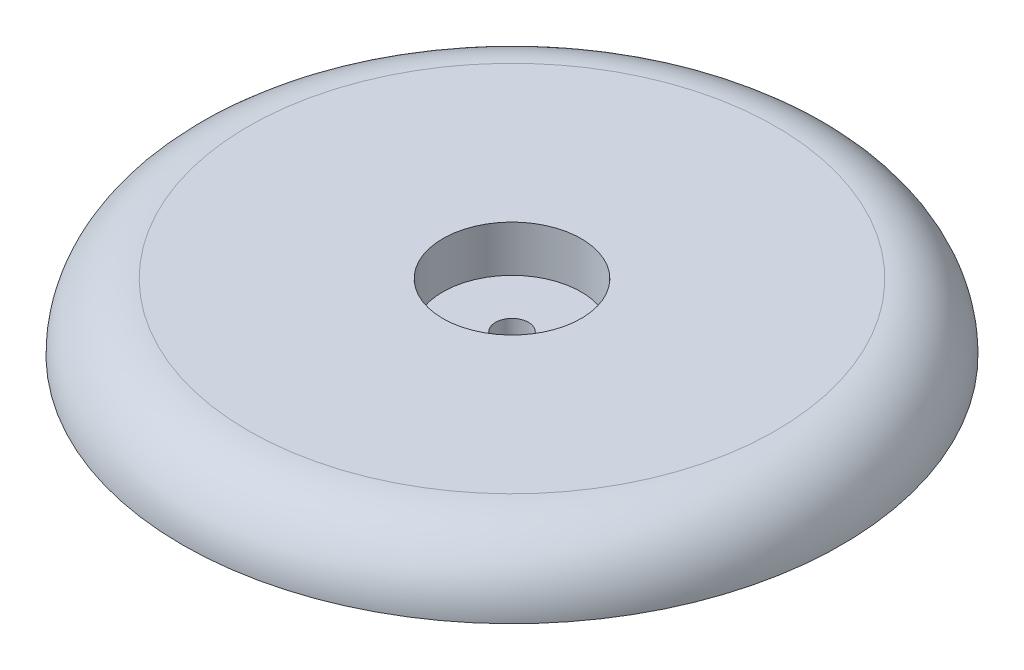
SolidWorks part; units mm, degrees
ref_plane "Ebene vorne" through (0, 0, 0) normal (0, 0, 1) x (1, 0, 0)
ref_plane "Ebene oben" through (0, 0, 0) normal (0, 1, 0) x (1, 0, 0)
ref_plane "Ebene rechts" through (0, 0, 0) normal (1, 0, 0) x (0, 0, -1)
sketch "Skizze1" plane through (0, 0, 0) normal (0, 1, 0) x (1, 0, 0)
  circle A0 centre (0, 0) radius 50
  dimension "D1" = 100
extrude "Aufsatz-Linear austragen1" add sketch "Skizze1" along normal blind 10
sketch "Skizze2" plane through (0, 10, 0) normal (0, 1, 0) x (1, 0, 0)
  circle A0 centre (0, 0) radius 10.5
  dimension "D1" = 21
extrude "Schnitt-Linear austragen1" cut sketch "Skizze2" against normal blind 7
fillet "Verrundung2" radius 10 1 edges at (0, 10, 50)
sketch "Skizze4" plane through (0, 3, 0) normal (0, 1, 0) x (1, 0, 0)
  circle A0 centre (0, 0) radius 2.5
  dimension "D1" = 5
extrude "Schnitt-Linear austragen2" cut sketch "Skizze4" against normal blind 7
